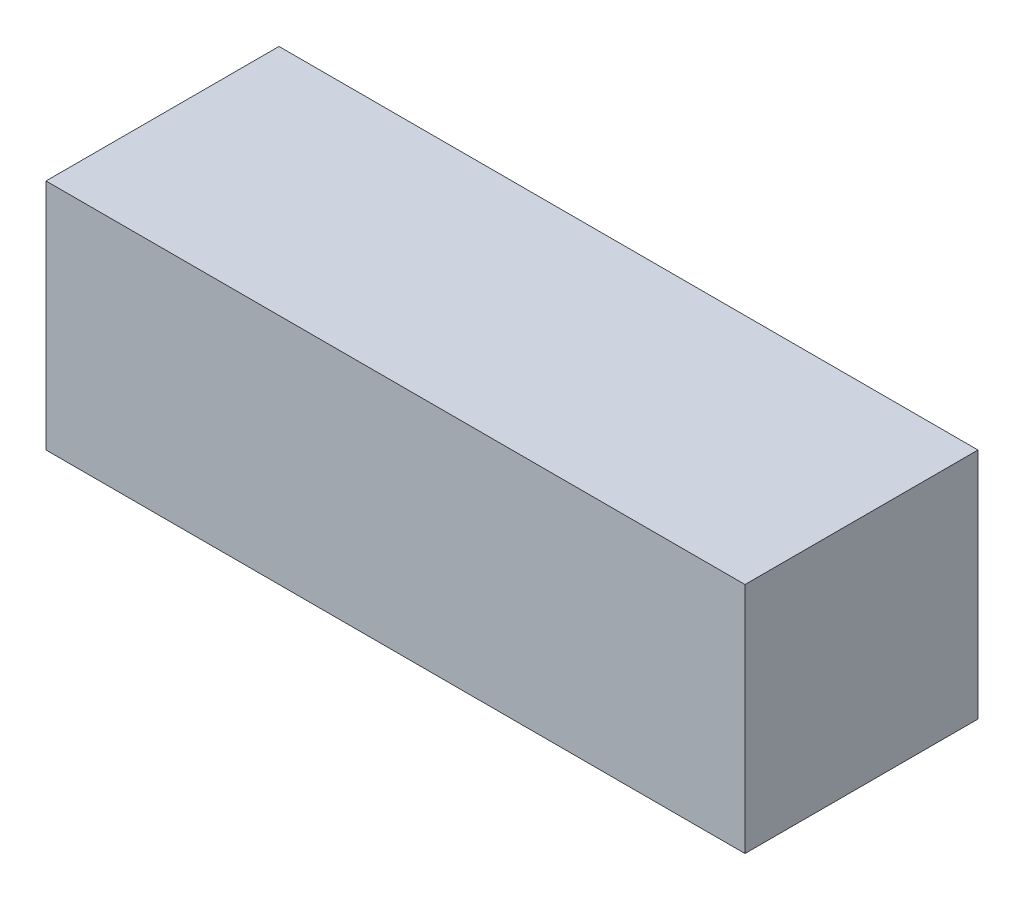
SolidWorks part; units mm, degrees
ref_plane "Alzado" through (0, 0, 0) normal (0, 0, 1) x (1, 0, 0)
ref_plane "Planta" through (0, 0, 0) normal (0, 1, 0) x (1, 0, 0)
ref_plane "Vista lateral" through (0, 0, 0) normal (1, 0, 0) x (0, 0, -1)
sketch "Croquis1" plane through (0, 0, 0) normal (0, 0, 1) x (1, 0, 0)
  line L1 (-15, -5) -> (15, -5)
  line L2 (-15, -5) -> (-15, 5)
  line L3 (-15, 5) -> (15, 5)
  line L4 (15, -5) -> (15, 5)
  line L5 (-15, -5) -> (15, 5) construction
  line L6 (-15, 5) -> (15, -5) construction
  point P0 (0, 0)
  dimension "D1" = 30
  dimension "D2" = 10
extrude "Saliente-Extruir1" add sketch "Croquis1" along normal blind 10
